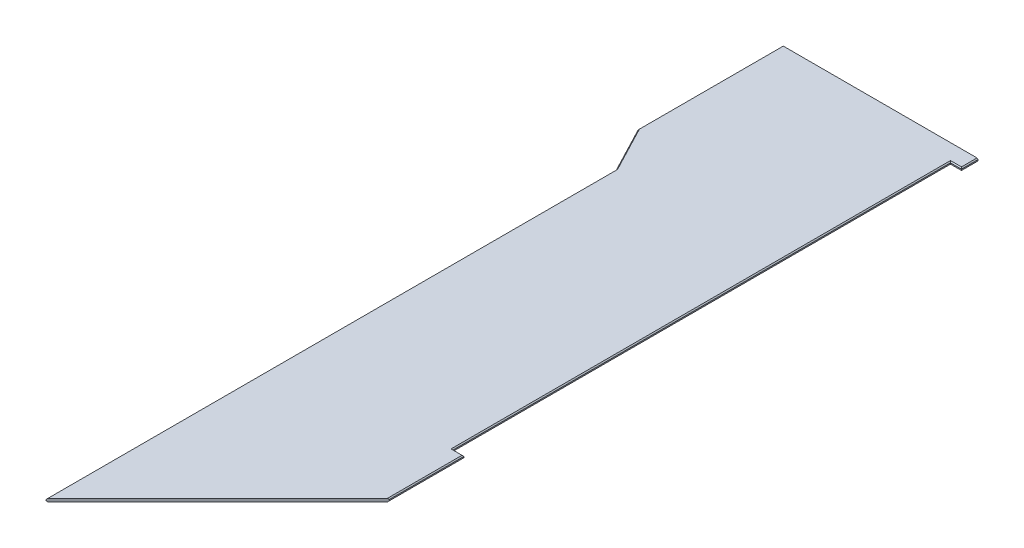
SolidWorks part; units mm, degrees
ref_plane "Front Plane" through (0, 0, 0) normal (1, 0, 0) x (0, 1, 0)
ref_plane "Top Plane" through (0, 0, 0) normal (0, 0, 1) x (0, 1, 0)
ref_plane "Right Plane" through (0, 0, 0) normal (0, 1, 0) x (-1, 0, 0)
sketch "Sketch2"
sketch_block_instance "Block4-1"
sketch_block "Block4" parameters "D1"=6, "D2"=6
extrude "Boss-Extrude2" add sketch "Sketch2" along normal mid plane 19.05
chamfer "Chamfer1" distance 6 angle 45 16 edges at (-487.0608, -9.525, 759.0185) (-559.6545, -9.525, -1106.1244) (-632.2483, -9.525, -1681.2829) (-487.0608, 9.525, 759.0185) (-559.6545, 9.525, -1106.1244) (-632.2483, 9.525, -1681.2829) (552.5517, -9.525, -2067.5462) (519.3017, -9.525, -2017.5462) (486.0517, -9.525, -511.5462) (519.3017, -9.525, 994.4538) (552.5517, -9.525, 1220.0538) (552.5517, 9.525, -2067.5462) (519.3017, 9.525, -2017.5462) (486.0517, 9.525, -511.5462) (519.3017, 9.525, 994.4538) (552.5517, 9.525, 1220.0538)
